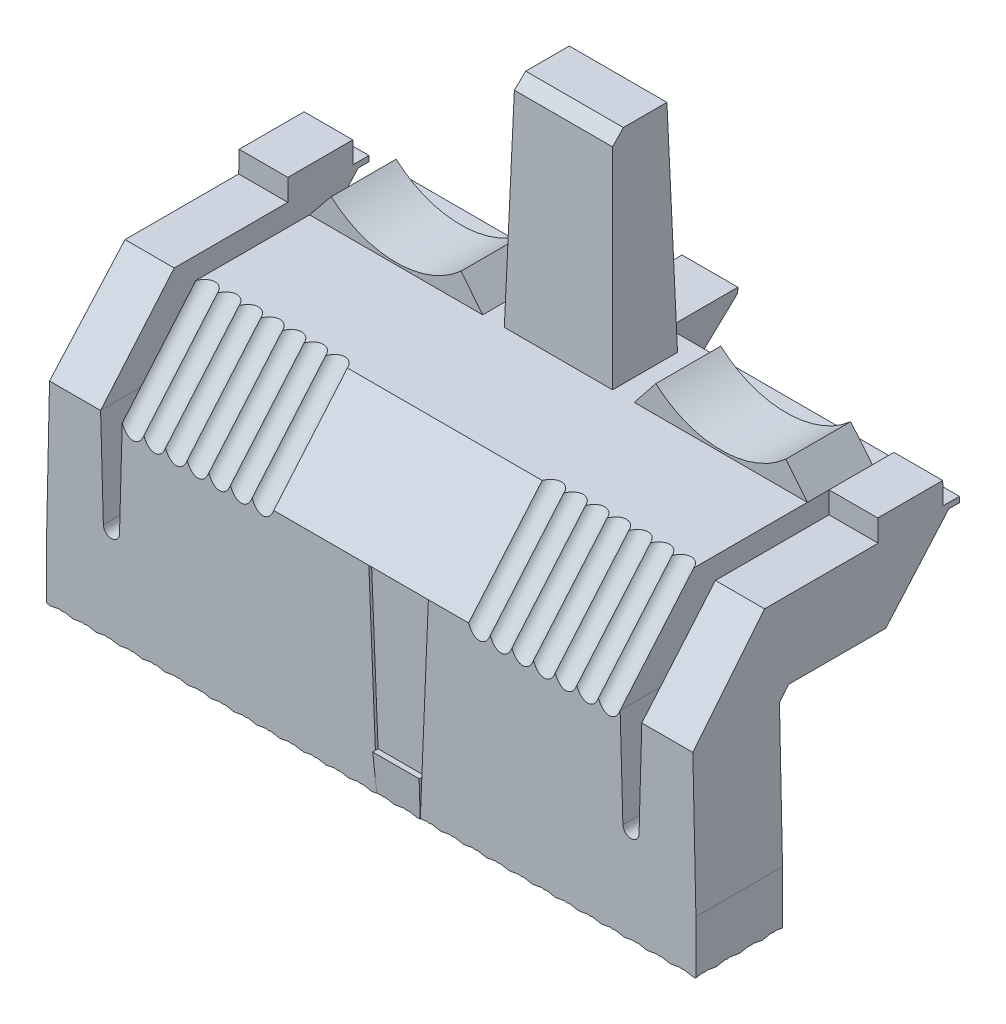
SolidWorks part; units mm, degrees
ref_plane "Plan de face" through (0, 0, 0) normal (0, 0, 1) x (1, 0, 0)
ref_plane "Plan de dessus" through (0, 0, 0) normal (0, 1, 0) x (1, 0, 0)
ref_plane "Plan de droite" through (0, 0, 0) normal (1, 0, 0) x (0, 0, -1)
sketch "Esquisse1" plane through (0, 0, 0) normal (1, 0, 0) x (0, 0, -1)
  line L0 (-4, -10) -> (4, -10)
  line L1 (4, -10) -> (4, 8)
  line L2 (-4, -10) -> (-4, 8)
  line L3 (-4, 8) -> (2.8007, 16)
  line L4 (2.8007, 16) -> (13.3007, 16)
  line L5 (4, 8) -> (4.8501, 9)
  line L6 (4.8501, 9) -> (13.8501, 9)
  line L7 (13.3007, 16) -> (13.3007, 36)
  line L8 (13.3007, 36) -> (19.3007, 36)
  line L9 (19.3007, 36) -> (19.3007, 16)
  line L10 (19.3007, 16) -> (20.8007, 16)
  line L11 (20.8007, 16) -> (20.8007, 15.5)
  line L12 (20.8007, 15.5) -> (19.8007, 15.5)
  line L13 (19.8007, 15.5) -> (13.8501, 9)
  dimension "D1" = 8
  dimension "D2" = 18
  dimension "D3" = 18
  dimension "D4" = 8
  dimension "D5" = 10.5
  dimension "D6" = 10.5
  dimension "D7" = 1
  dimension "D8" = 9
  dimension "D9" = 20
  dimension "D10" = 6
  dimension "D11" = 20
  dimension "D12" = 1.5
  dimension "D13" = 0.5
  dimension "D14" = 1
  dimension "D15" = 4
  dimension "D16" = 10
  dimension "D17" = 8.8125
extrude "Extrusion1" add sketch "Esquisse1" along normal mid plane 60
sketch "Esquisse3" plane through (0, 0, 4) normal (0, 0, 1) x (1, 0, 0)
  line L0 (-30, -5) -> (-30, 37.0193)
  line L1 (30, -10) -> (-30, -10) construction
  line L2 (0, 37.8792) -> (0, -12.942) construction
  line L3 (-21, 18.4528) -> (-9, 18.5)
  line L4 (-30, 37.0193) -> (-5, 37.0193)
  line L5 (-25, 18) -> (-25, 8)
  line L6 (30, 8) -> (-30, 8) construction
  line L7 (-23, 16) -> (-23, 8)
  line L8 (-29.5, 18) -> (-25, 18)
  line L10 (-30, -5) -> (-29.5, 18)
  line L12 (21, 18.4528) -> (9, 18.5)
  line L13 (-5, 37.0193) -> (-5, 16)
  line L14 (5, 37.0193) -> (30, 37.0193)
  line L15 (30, -5) -> (30, 37.0193)
  line L16 (-25, 8) -> (-24.7466, -1.021)
  line L17 (-23, 8) -> (-23.2534, -1.021)
  line L20 (-23, 16) -> (-21, 18.4528)
  line L21 (-7, 16) -> (-9, 18.5)
  line L22 (30, 16) -> (-30, 16) construction
  line L23 (-7, 16) -> (-5, 16)
  line L24 (7, 16) -> (5, 16)
  line L25 (5, 37.0193) -> (5, 16)
  line L27 (7, 16) -> (9, 18.5)
  line L29 (23, 16) -> (21, 18.4528)
  line L30 (23, 16) -> (23, 8)
  line L31 (23, 8) -> (23.2534, -1.021)
  line L32 (25, 8) -> (24.7466, -1.021)
  line L33 (25, 18) -> (25, 8)
  line L34 (25, 18) -> (29.5, 18)
  line L35 (30, -5) -> (29.5, 18)
  arc A0 (-24.7466, -1.021) -> (-23.2534, -1.021) centre (-24, -1) ccw
  arc A1 (24.7466, -1.021) -> (23.2534, -1.021) centre (24, -1) cw
  dimension "D9" = 9
  dimension "D12" = 0.7469
  dimension "D14" = 0.5
  dimension "D2" = 8
  dimension "D3" = 4.5
  dimension "D4" = 2
  dimension "D5" = 10
  dimension "D6" = 2
  dimension "D7" = 4
  dimension "D8" = 42.0193
  dimension "D10" = 25
  dimension "D11" = 16
  dimension "D13" = 2
  dimension "D15" = 12.0001
  dimension "D16" = 10
  dimension "D17" = 2.5
  dimension "D18" = 23
  dimension "D19" = 5
  dimension "D20" = 9.021
extrude "Enlèv. mat.-Extru.1" cut sketch "Esquisse3" against normal through all
sketch "Esquisse4" plane through (0, 0, 4) normal (0, 0, 1) x (1, 0, 0)
  line L0 (0, 37.4199) -> (0, 12.2219) construction
  circle A0 centre (-15.0264, 25.1845) radius 9
  circle A1 centre (15.0264, 25.1845) radius 9
extrude "Enlèv. mat.-Extru.2" cut sketch "Esquisse4" against normal through all
draft "Dépouille3" type of draft neutral plane draft angle 1.4 faces to draft 1 parameters "D1"=1.4
draft "Dépouille4" type of draft neutral plane draft angle 1.4 faces to draft 1 parameters "D1"=1.4
draft "Dépouille5" type of draft neutral plane draft angle 1.4 faces to draft 1 parameters "D1"=1.4
draft "Dépouille6" type of draft neutral plane draft angle 1.4 faces to draft 1 parameters "D1"=1.4
chamfer "Chanfrein2" distance 1 angle 45 1 edges at (0, 36, -13.7895)
sketch "Esquisse7" plane through (0, 0, 0) normal (1, 0, 0) x (0, 0, -1)
  line L0 (5.5, 6.5) -> (6, -2.5)
  line L1 (6, -2.5) -> (10, -2.5)
  line L2 (13.8501, 9) -> (4.8501, 9) construction
  line L3 (4, 8) -> (4, -5) construction
  line L4 (19.8007, 15.5) -> (27.3007, 15.5)
  line L5 (27.3007, 15.5) -> (10, -2.5)
  line L6 (19.8007, 15.5) -> (13.8501, 9)
  line L7 (13.8501, 9) -> (4.8501, 9)
  line L8 (4.8501, 9) -> (4, 8)
  arc A0 (5.5, 6.5) -> (4, 8) centre (3.9118, 6.4118) ccw
  dimension "D5" = 9
  dimension "D1" = 11.5
  dimension "D2" = 4
  dimension "D3" = 2
  dimension "D4" = 1.5
  dimension "D6" = 7.5
extrude "Extrusion2" add sketch "Esquisse7" along normal mid plane 4.5
sketch "Esquisse8" plane through (2.25, 0, 0) normal (1, 0, 0) x (0, 0, -1)
  line L0 (20.8007, 15.5) -> (20.8007, 16)
  line L1 (20.8007, 16) -> (27.3007, 16)
  line L2 (27.3007, 16) -> (27.3007, 15.5)
  line L3 (27.3007, 15.5) -> (20.8007, 15.5)
extrude "Extrusion3" add sketch "Esquisse8" against normal blind 4.5
draft "Dépouille7" type of draft neutral plane draft angle 2.7 faces to draft 1 parameters "D1"=2.7
draft "Dépouille8" type of draft neutral plane draft angle 2.7 faces to draft 1 parameters "D1"=2.7
sketch "Esquisse9" plane through (0, 0, 4) normal (0, 0, 1) x (1, 0, 0)
  line L0 (-0.2174, 8) -> (0.5326, -10)
  line L1 (23, 8) -> (-23, 8) construction
  line L2 (30, -10) -> (-30, -10) construction
  line L3 (0.5326, -10) -> (4.5326, -10)
  line L4 (4.5326, -10) -> (5.2826, 8)
  line L5 (5.2826, 8) -> (-0.2174, 8)
  dimension "D1" = 4
  dimension "D2" = 5.5
  dimension "D3" = 29.5
  dimension "D4" = 0.75
extrude "Enlèv. mat.-Extru.4" cut sketch "Esquisse9" against normal blind 0.25
sketch "Esquisse10" plane through (0, 0, 3.75) normal (0, 0, 1) x (1, 0, 0)
  line L0 (0.5326, -10) -> (4.5326, -10)
  line L1 (4.5326, -10) -> (4.6784, -6.5)
  line L2 (4.5326, -10) -> (5.2826, 8) construction
  line L3 (4.6784, -6.5) -> (0.3868, -6.5)
  line L4 (-0.2174, 8) -> (0.5326, -10) construction
  line L5 (0.3868, -6.5) -> (0.5326, -10)
  dimension "D1" = 3.5
extrude "Extrusion4" add sketch "Esquisse10" along normal blind 0.5
sketch "Esquisse11" plane through (0, 0, 0) normal (1, 0, 0) x (0, 0, -1)
  line L0 (-4.25, -6.5) -> (-4, -10)
  line L1 (-4.25, -6.5) -> (-4.25, -10)
  line L2 (-4.25, -10) -> (-4, -10)
extrude "Enlèv. mat.-Extru.6" cut sketch "Esquisse11" along normal through all
sketch "Esquisse12" plane through (0, 0, -4) normal (0, 0, -1) x (-1, 0, 0)
  line L0 (28.8, 11.9292) -> (28.2, -4)
  line L1 (28.2, -4) -> (27.2, -4)
  line L2 (27.2, -4) -> (26.6, 11.9292)
  line L3 (26.6, 11.9292) -> (28.8, 11.9292)
  line L4 (-30, -10) -> (30, -10) construction
  line L5 (30, -10) -> (30, -5) construction
  line L6 (0, 20.6063) -> (0, -14.1258) construction
  line L7 (-26.6, 11.9292) -> (-28.8, 11.9292)
  line L8 (-28.8, 11.9292) -> (-28.2, -4)
  line L9 (-27.2, -4) -> (-26.6, 11.9292)
  line L10 (-28.2, -4) -> (-27.2, -4)
  dimension "D1" = 1
  dimension "D2" = 2.2
  dimension "D3" = 6
  dimension "D4" = 0.6
  dimension "D5" = 15.9292
  dimension "D6" = 1.2
extrude "Extrusion5" add sketch "Esquisse12" along normal blind 1
sketch "Esquisse13" plane through (0, 0, -4) normal (0, 0, -1) x (-1, 0, 0)
  line L0 (3, -9.5) -> (3, 11.2203)
  line L1 (3, 11.2203) -> (4, 11.2203)
  line L2 (4, 11.2203) -> (4, -9.5)
  line L3 (4, -9.5) -> (3, -9.5)
  line L4 (30, -10) -> (30, -5) construction
  line L5 (-30, -10) -> (30, -10) construction
  dimension "D1" = 1
  dimension "D2" = 26
  dimension "D3" = 0.5
  dimension "D4" = 20.7203
extrude "Extrusion6" add sketch "Esquisse13" along normal blind 1
sketch "Esquisse14" plane through (0, 0.481, -19.68) normal (0, 0.0244, -0.9997) x (-1, 0, 0)
  line L0 (-4.5112, 35.5296) -> (4.5112, 35.5296) construction
  line L1 (-2.5, 31.5296) -> (2.5, 31.5296)
  line L2 (-2.5, 31.5296) -> (-2.5, 28.0296)
  line L3 (-2.5, 28.0296) -> (2.5, 28.0296)
  line L4 (2.5, 31.5296) -> (2.5, 28.0296)
  line L5 (30, -4.9008) -> (30, -9.8993) construction
  point P4 (0, 35.5296)
  point P7 (30, -7.4)
  dimension "D1" = 4
  dimension "D2" = 3.5
  dimension "D3" = 5
  dimension "D4" = 27.5
extrude "Enlèv. mat.-Extru.8" cut sketch "Esquisse14" against normal blind 3
ref_plane "Plan1" through (0, 2.6701, -2.2698) normal (0, 0.7619, -0.6477) x (-1, 0, 0)
sketch "Esquisse15" plane through (0, 2.6701, -2.2698) normal (0, 0.7619, -0.6477) x (-1, 0, 0)
  line L1 (0.2174, 8.2291) -> (23, 8.2291) construction
  line L2 (9, 8.2291) -> (9, 10.7006)
  line L3 (9, 10.7006) -> (23, 10.4341)
  line L4 (23, 10.4341) -> (23, 8.2291)
  line L5 (0, 0) -> (0, 27.746) construction
  line L6 (-23, 10.4341) -> (-23, 8.2291)
  line L7 (-9, 10.7006) -> (-23, 10.4341)
  line L8 (-9, 8.2291) -> (-9, 10.7006)
  arc A0 (23, 8.2291) -> (21, 8.2291) centre (22, 8.7755) cw
  arc A1 (21, 8.2291) -> (19, 8.2291) centre (20, 8.7755) cw
  arc A2 (19, 8.2291) -> (17, 8.2291) centre (18, 8.7755) cw
  arc A3 (17, 8.2291) -> (15, 8.2291) centre (16, 8.7755) cw
  arc A4 (15, 8.2291) -> (13, 8.2291) centre (14, 8.7755) cw
  arc A5 (13, 8.2291) -> (11, 8.2291) centre (12, 8.7755) cw
  arc A6 (11, 8.2291) -> (9, 8.2291) centre (10, 8.7755) cw
  arc A7 (-11, 8.2291) -> (-9, 8.2291) centre (-10, 8.7755) ccw
  arc A8 (-13, 8.2291) -> (-11, 8.2291) centre (-12, 8.7755) ccw
  arc A9 (-15, 8.2291) -> (-13, 8.2291) centre (-14, 8.7755) ccw
  arc A10 (-17, 8.2291) -> (-15, 8.2291) centre (-16, 8.7755) ccw
  arc A11 (-19, 8.2291) -> (-17, 8.2291) centre (-18, 8.7755) ccw
  arc A12 (-21, 8.2291) -> (-19, 8.2291) centre (-20, 8.7755) ccw
  arc A13 (-23, 8.2291) -> (-21, 8.2291) centre (-22, 8.7755) ccw
  dimension "D2" = 1.1395
  dimension "D1" = 2
extrude "Enlèv. mat.-Extru.9" cut sketch "Esquisse15" against normal mid plane 50
ref_plane "Plan9" through (17, 0, -17) normal (0.7071, 0, -0.7071) x (-0.7071, 0, -0.7071)
sketch "Esquisse20" plane through (17, 0, -17) normal (0.7071, 0, -0.7071) x (-0.7071, 0, -0.7071)
  line L0 (-22.5416, -10) -> (-21.7916, -9.8)
  line L1 (-22.4371, -10) -> (-24.6051, -10) construction
  line L2 (-13.3018, -10) -> (-23.4677, -10) construction
  line L3 (-24.0416, -9.4208) -> (-24.0416, -10.4434) construction
  line L4 (-24.0416, -5) -> (-24.0416, -10) construction
  line L5 (-24.0416, -10) -> (-23.2916, -9.8)
  line L6 (-23.2916, -9.8) -> (-22.5416, -10)
  line L7 (-14.8018, -10) -> (-21.9677, -10) construction
  line L9 (-21.7916, -9.8) -> (-21.0416, -10)
  line L10 (-21.0416, -10) -> (-20.2916, -9.8)
  line L11 (-20.2916, -9.8) -> (-19.5416, -10)
  line L12 (-19.5416, -10) -> (-18.7916, -9.8)
  line L13 (-18.7916, -9.8) -> (-18.0416, -10)
  line L14 (-18.0416, -10) -> (-17.2916, -9.8)
  line L15 (-17.2916, -9.8) -> (-16.5416, -10)
  line L16 (-16.5416, -10) -> (-15.7916, -9.8)
  line L17 (-15.7916, -9.8) -> (-15.0416, -10)
  line L18 (-15.0416, -10) -> (-14.2916, -9.8)
  line L19 (-14.2916, -9.8) -> (-13.5416, -10)
  line L20 (-13.5416, -10) -> (-12.7916, -9.8)
  line L21 (-12.7916, -9.8) -> (-12.0416, -10)
  line L22 (-12.0416, -10) -> (-11.2916, -9.8)
  line L23 (-11.2916, -9.8) -> (-10.5416, -10)
  line L24 (-10.5416, -10) -> (-9.7916, -9.8)
  line L25 (-9.7916, -9.8) -> (-9.0416, -10)
  line L26 (-9.0416, -10) -> (-8.2916, -9.8)
  line L27 (-8.2916, -9.8) -> (-7.5416, -10)
  line L28 (-7.5416, -10) -> (-6.7916, -9.8)
  line L29 (-6.7916, -9.8) -> (-6.0416, -10)
  line L30 (-6.0416, -10) -> (-5.2916, -9.8)
  line L31 (-5.2916, -9.8) -> (-4.5416, -10)
  line L32 (-4.5416, -10) -> (-3.7916, -9.8)
  line L33 (-3.7916, -9.8) -> (-3.0416, -10)
  line L34 (-3.0416, -10) -> (-2.2916, -9.8)
  line L35 (-2.2916, -9.8) -> (-1.5416, -10)
  line L36 (-1.5416, -10) -> (-0.7916, -9.8)
  line L37 (-0.7916, -9.8) -> (-0.0416, -10)
  line L38 (-0.0416, -10) -> (0.7084, -9.8)
  line L39 (0.7084, -9.8) -> (1.4584, -10)
  line L40 (1.4584, -10) -> (2.2084, -9.8)
  line L41 (2.2084, -9.8) -> (2.9584, -10)
  line L42 (2.9584, -10) -> (3.7084, -9.8)
  line L43 (3.7084, -9.8) -> (4.4584, -10)
  line L44 (4.4584, -10) -> (5.2084, -9.8)
  line L45 (5.2084, -9.8) -> (5.9584, -10)
  line L46 (5.9584, -10) -> (6.7084, -9.8)
  line L47 (6.7084, -9.8) -> (7.4584, -10)
  line L48 (7.4584, -10) -> (8.2084, -9.8)
  line L49 (8.2084, -9.8) -> (8.9584, -10)
  line L50 (8.9584, -10) -> (9.7084, -9.8)
  line L51 (9.7084, -9.8) -> (10.4584, -10)
  line L52 (10.4584, -10) -> (11.2084, -9.8)
  line L53 (11.2084, -9.8) -> (11.9584, -10)
  line L54 (11.9584, -10) -> (12.7084, -9.8)
  line L55 (12.7084, -9.8) -> (13.4584, -10)
  line L56 (13.4584, -10) -> (14.2084, -9.8)
  line L57 (14.2084, -9.8) -> (14.9584, -10)
  line L58 (14.9584, -10) -> (15.7084, -9.8)
  line L59 (15.7084, -9.8) -> (16.4584, -10)
  line L60 (16.4584, -10) -> (17.2084, -9.8)
  line L61 (17.2084, -9.8) -> (17.9584, -10)
  line L62 (17.9584, -10) -> (18.7084, -9.8)
  line L63 (18.7084, -9.8) -> (19.4584, -10)
  line L64 (19.4584, -10) -> (20.2084, -9.8)
  line L65 (20.2084, -9.8) -> (20.9584, -10)
  line L66 (20.9584, -10) -> (21.7084, -9.8)
  line L67 (21.7084, -9.8) -> (22.4584, -10)
  line L68 (22.4584, -10) -> (23.2084, -9.8)
  line L69 (23.2084, -9.8) -> (23.9584, -10)
  line L70 (23.9584, -10) -> (24.7084, -9.8)
  line L71 (24.7084, -9.8) -> (25.4584, -10)
  line L72 (25.4584, -10) -> (26.2084, -9.8)
  line L73 (26.2084, -9.8) -> (26.9584, -10)
  line L74 (26.9584, -10) -> (27.7084, -9.8)
  line L75 (27.7084, -9.8) -> (28.4584, -10)
  line L76 (28.4584, -10) -> (29.2084, -9.8)
  line L77 (29.2084, -9.8) -> (29.9584, -10)
  line L78 (29.9584, -10) -> (30.7084, -9.8)
  line L79 (30.7084, -9.8) -> (31.4584, -10)
  line L80 (31.4584, -10) -> (32.2084, -9.8)
  line L81 (32.2084, -9.8) -> (32.9584, -10)
  line L82 (32.9584, -10) -> (33.7084, -9.8)
  line L83 (33.7084, -9.8) -> (34.4584, -10)
  line L84 (34.4584, -10) -> (35.2084, -9.8)
  line L85 (35.2084, -9.8) -> (35.9584, -10)
  line L86 (-24.0416, -10) -> (-24.0416, -10.905)
  line L87 (-24.0416, -10.905) -> (35.9584, -10.905)
  line L88 (35.9584, -10.905) -> (35.9584, -10)
  dimension "D1" = 0.2
  dimension "D2" = 0.75
  dimension "D3" = 0.75
extrude "Enlèv. mat.-Extru.13" cut sketch "Esquisse20" against normal through all
ref_plane "Plan10" through (17, 0, 17) normal (0.7071, 0, 0.7071) x (0.7071, 0, -0.7071)
sketch "Esquisse21" plane through (17, 0, 17) normal (0.7071, 0, 0.7071) x (0.7071, 0, -0.7071)
  line L0 (24.0416, -9.0553) -> (24.0416, -10.2687) construction
  line L1 (24.0416, -9.9085) -> (24.0416, -5) construction
  line L2 (23.3274, -10) -> (24.312, -10) construction
  line L3 (12.3848, -10) -> (23.6985, -10) construction
  line L4 (24.0416, -10) -> (23.2916, -9.8)
  line L5 (13.1348, -9.8) -> (23.6348, -9.8) construction
  line L6 (23.2916, -9.8) -> (22.5416, -10)
  line L7 (13.8848, -10) -> (22.8848, -10) construction
  line L8 (21.7916, -9.8) -> (21.0416, -10)
  line L9 (22.5416, -10) -> (21.7916, -9.8)
  line L10 (20.2916, -9.8) -> (19.5416, -10)
  line L11 (21.0416, -10) -> (20.2916, -9.8)
  line L12 (18.7916, -9.8) -> (18.0416, -10)
  line L13 (19.5416, -10) -> (18.7916, -9.8)
  line L14 (17.2916, -9.8) -> (16.5416, -10)
  line L15 (18.0416, -10) -> (17.2916, -9.8)
  line L16 (15.7916, -9.8) -> (15.0416, -10)
  line L17 (16.5416, -10) -> (15.7916, -9.8)
  line L18 (14.2916, -9.8) -> (13.5416, -10)
  line L19 (15.0416, -10) -> (14.2916, -9.8)
  line L20 (12.7916, -9.8) -> (12.0416, -10)
  line L21 (13.5416, -10) -> (12.7916, -9.8)
  line L22 (11.2916, -9.8) -> (10.5416, -10)
  line L23 (12.0416, -10) -> (11.2916, -9.8)
  line L24 (9.7916, -9.8) -> (9.0416, -10)
  line L25 (10.5416, -10) -> (9.7916, -9.8)
  line L26 (8.2916, -9.8) -> (7.5416, -10)
  line L27 (9.0416, -10) -> (8.2916, -9.8)
  line L28 (6.7916, -9.8) -> (6.0416, -10)
  line L29 (7.5416, -10) -> (6.7916, -9.8)
  line L30 (5.2916, -9.8) -> (4.5416, -10)
  line L31 (6.0416, -10) -> (5.2916, -9.8)
  line L32 (3.7916, -9.8) -> (3.0416, -10)
  line L33 (4.5416, -10) -> (3.7916, -9.8)
  line L34 (2.2916, -9.8) -> (1.5416, -10)
  line L35 (3.0416, -10) -> (2.2916, -9.8)
  line L36 (0.7916, -9.8) -> (0.0416, -10)
  line L37 (1.5416, -10) -> (0.7916, -9.8)
  line L38 (-0.7084, -9.8) -> (-1.4584, -10)
  line L39 (0.0416, -10) -> (-0.7084, -9.8)
  line L40 (-2.2084, -9.8) -> (-2.9584, -10)
  line L41 (-1.4584, -10) -> (-2.2084, -9.8)
  line L42 (-3.7084, -9.8) -> (-4.4584, -10)
  line L43 (-2.9584, -10) -> (-3.7084, -9.8)
  line L44 (-5.2084, -9.8) -> (-5.9584, -10)
  line L45 (-4.4584, -10) -> (-5.2084, -9.8)
  line L46 (-6.7084, -9.8) -> (-7.4584, -10)
  line L47 (-5.9584, -10) -> (-6.7084, -9.8)
  line L48 (-8.2084, -9.8) -> (-8.9584, -10)
  line L49 (-7.4584, -10) -> (-8.2084, -9.8)
  line L50 (-9.7084, -9.8) -> (-10.4584, -10)
  line L51 (-8.9584, -10) -> (-9.7084, -9.8)
  line L52 (-11.2084, -9.8) -> (-11.9584, -10)
  line L53 (-10.4584, -10) -> (-11.2084, -9.8)
  line L54 (-12.7084, -9.8) -> (-13.4584, -10)
  line L55 (-11.9584, -10) -> (-12.7084, -9.8)
  line L56 (-14.2084, -9.8) -> (-14.9584, -10)
  line L57 (-13.4584, -10) -> (-14.2084, -9.8)
  line L58 (-15.7084, -9.8) -> (-16.4584, -10)
  line L59 (-14.9584, -10) -> (-15.7084, -9.8)
  line L60 (-17.2084, -9.8) -> (-17.9584, -10)
  line L61 (-16.4584, -10) -> (-17.2084, -9.8)
  line L62 (-18.7084, -9.8) -> (-19.4584, -10)
  line L63 (-17.9584, -10) -> (-18.7084, -9.8)
  line L64 (-20.2084, -9.8) -> (-20.9584, -10)
  line L65 (-19.4584, -10) -> (-20.2084, -9.8)
  line L66 (-21.7084, -9.8) -> (-22.4584, -10)
  line L67 (-20.9584, -10) -> (-21.7084, -9.8)
  line L68 (-23.2084, -9.8) -> (-23.9584, -10)
  line L69 (-22.4584, -10) -> (-23.2084, -9.8)
  line L70 (-24.7084, -9.8) -> (-25.4584, -10)
  line L71 (-23.9584, -10) -> (-24.7084, -9.8)
  line L72 (-26.2084, -9.8) -> (-26.9584, -10)
  line L73 (-25.4584, -10) -> (-26.2084, -9.8)
  line L74 (-27.7084, -9.8) -> (-28.4584, -10)
  line L75 (-26.9584, -10) -> (-27.7084, -9.8)
  line L76 (-29.2084, -9.8) -> (-29.9584, -10)
  line L77 (-28.4584, -10) -> (-29.2084, -9.8)
  line L78 (-30.7084, -9.8) -> (-31.4584, -10)
  line L79 (-29.9584, -10) -> (-30.7084, -9.8)
  line L80 (-32.2084, -9.8) -> (-32.9584, -10)
  line L81 (-31.4584, -10) -> (-32.2084, -9.8)
  line L82 (-33.7084, -9.8) -> (-34.4584, -10)
  line L83 (-32.9584, -10) -> (-33.7084, -9.8)
  line L84 (-35.2084, -9.8) -> (-35.9584, -10)
  line L85 (-34.4584, -10) -> (-35.2084, -9.8)
  line L86 (24.0416, -10) -> (24.0416, -10.4019)
  line L87 (24.0416, -10.4019) -> (-35.9584, -10.2687)
  line L88 (-35.9584, -10.2687) -> (-35.9584, -10)
  dimension "D1" = 0.75
  dimension "D2" = 0.75
extrude "Enlèv. mat.-Extru.14" cut sketch "Esquisse21" against normal through all
